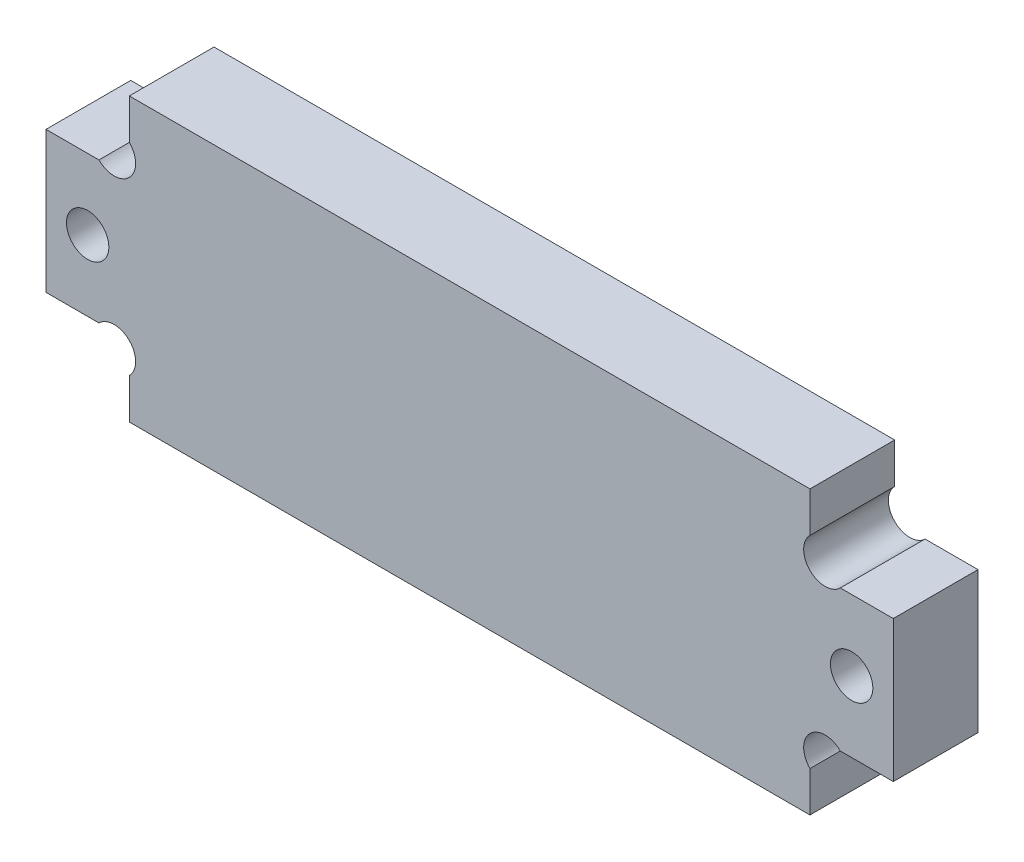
SolidWorks part; units mm, degrees
ref_plane "Plan de face" through (0, 0, 0) normal (0, 0, 1) x (1, 0, 0)
ref_plane "Plan de dessus" through (0, 0, 0) normal (0, 1, 0) x (1, 0, 0)
ref_plane "Plan de droite" through (0, 0, 0) normal (1, 0, 0) x (0, 0, -1)
sketch "Esquisse1" plane through (0, 0, 0) normal (0, 0, 1) x (1, 0, 0)
  line L0 (0, 40.2835) -> (0, -21.307) construction
  line L1 (30, 26.0222) -> (30, -7.3857) construction
  line L2 (-8.9057, 0) -> (97.6293, 0) construction
  line L3 (5.9, -4.0704) -> (5.9, 23.8545) construction
  line L4 (60, -10.6535) -> (60, 43.2798) construction
  line L5 (-4.8393, 10) -> (74.4089, 10) construction
  line L6 (99.5478, 20) -> (-8.9057, 20) construction
  line L7 (5.9, 5) -> (2.4344, 1.5344) construction
  line L8 (-3.0541, 5) -> (10, 5) construction
  line L9 (0, 5) -> (3.7504, 5)
  line L10 (5.9, 17.1496) -> (5.9, 20)
  line L11 (5.9, 2.8504) -> (5.9, 0)
  line L12 (0, 15) -> (3.7504, 15)
  line L13 (54.1, 20) -> (5.9, 20)
  line L14 (60, 15) -> (56.2496, 15)
  line L15 (0, 15) -> (0, 5)
  line L16 (54.1, 17.1496) -> (54.1, 20)
  line L17 (5.9, 0) -> (54.1, 0)
  line L18 (60, 15) -> (60, 5)
  line L19 (60, 5) -> (56.2496, 5)
  line L20 (54.1, 2.8504) -> (54.1, 0)
  line L21 (2.95, 17.6599) -> (2.95, 3.5185) construction
  arc A0 (5.9, 2.8504) -> (3.7504, 5) centre (4.8252, 3.9252) ccw
  arc A1 (5.9, 17.1496) -> (3.7504, 15) centre (4.8252, 16.0748) cw
  arc A2 (54.1, 17.1496) -> (56.2496, 15) centre (55.1748, 16.0748) ccw
  arc A3 (54.1, 2.8504) -> (56.2496, 5) centre (55.1748, 3.9252) cw
  circle A4 centre (2.95, 10) radius 1.5
  circle A5 centre (57.05, 10) radius 1.5
  dimension "D1" = 45
extrude "Extrusion1" add sketch "Esquisse1" along normal blind 6
